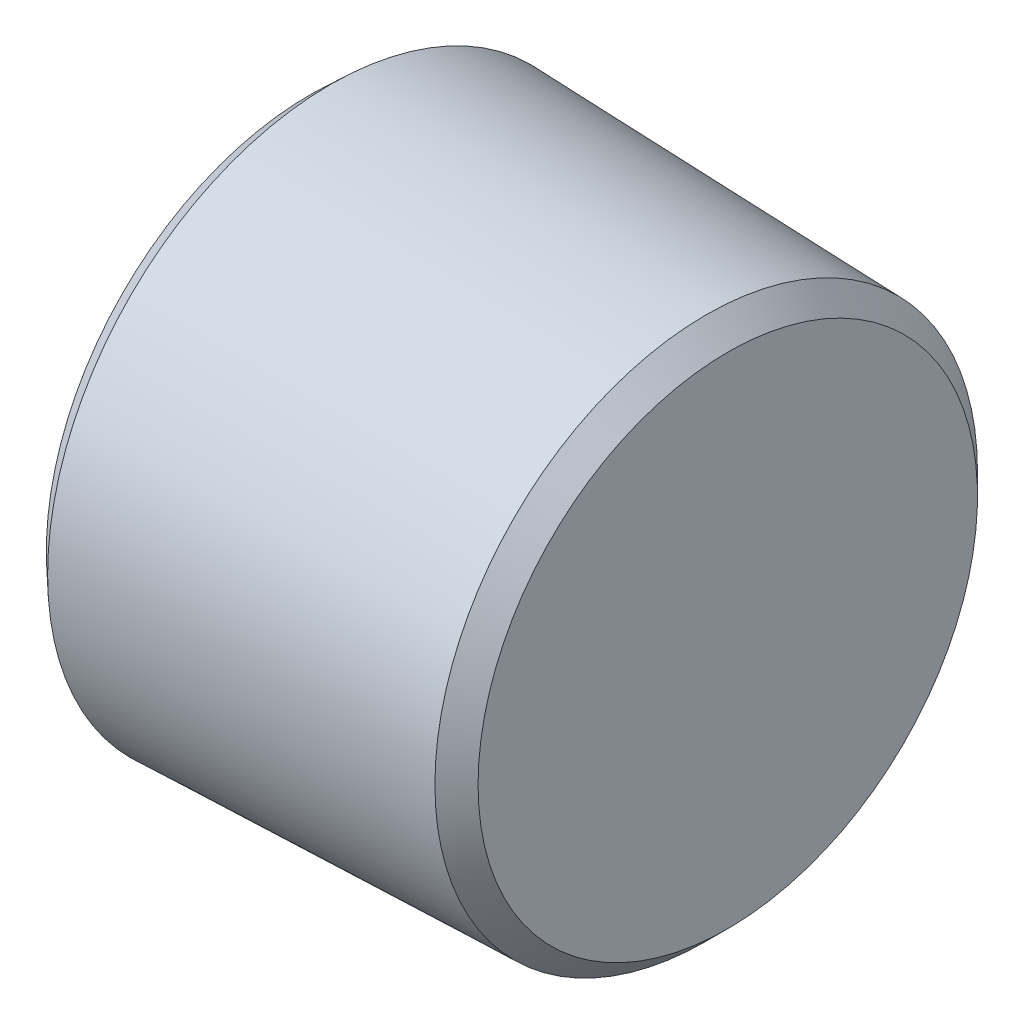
SolidWorks part; units mm, degrees
ref_plane "前视" through (0, 0, 0) normal (0, 0, 1) x (1, 0, 0)
ref_plane "上视" through (0, 0, 0) normal (0, 1, 0) x (1, 0, 0)
ref_plane "右视" through (0, 0, 0) normal (1, 0, 0) x (0, 0, -1)
sketch "草图1" plane through (0, 0, 0) normal (0, 0, 1) x (1, 0, 0)
  line L0 (0, 0) -> (22.0077, 0) construction
  line L1 (0, 0) -> (0, 6.786)
  line L2 (0, 6.786) -> (10, 6.4735)
  line L3 (10, 6.4735) -> (10, 0)
  line L4 (10, 0) -> (0, 0)
  line L5 (10, 6.4735) -> (16, 6.286) construction
  line L6 (16, 6.286) -> (16, 0) construction
  point P6 (16, 0)
  dimension "D1" = 16
  dimension "D2" = 10
  dimension "D5" = 12.572
  dimension "D6" = 13.572
revolve "旋转1" add sketch "草图1" angle 360 about L0
sketch "草图2" plane through (0, 0, 0) normal (1, 0, 0) x (0, 0, -1)
  line L1 (0, 3.4641) -> (-3, 1.7321)
  line L2 (-3, 1.7321) -> (-3, -1.7321)
  line L3 (-3, -1.7321) -> (0, -3.4641)
  line L4 (0, -3.4641) -> (3, -1.7321)
  line L5 (3, -1.7321) -> (3, 1.7321)
  line L6 (3, 1.7321) -> (0, 3.4641)
  circle A0 centre (0, 0) radius 3 construction
  dimension "D1" = 6
extrude "切除-拉伸1" cut sketch "草图2" along normal blind 3.5
sketch "草图3" plane through (0, 0, 0) normal (0, 1, 0) x (1, 0, 0)
  line L0 (3.5, 0) -> (3.5, -3) construction
  line L1 (3.5, 0) -> (3.5, -3)
  line L2 (0, 0) -> (5.4455, 0) construction
  line L3 (0, 0) -> (22.0077, 0) construction
  line L4 (3.5, -3) -> (5.2321, 0)
  line L5 (5.2321, 0) -> (3.5, 0)
  dimension "D1" = 60
revolve "切除-旋转4" cut sketch "草图3" angle 360 about L2
chamfer "倒角1" distance 0.5 angle 45 2 edges at (10, 0, 6.4735) (0, 0, 6.786)
